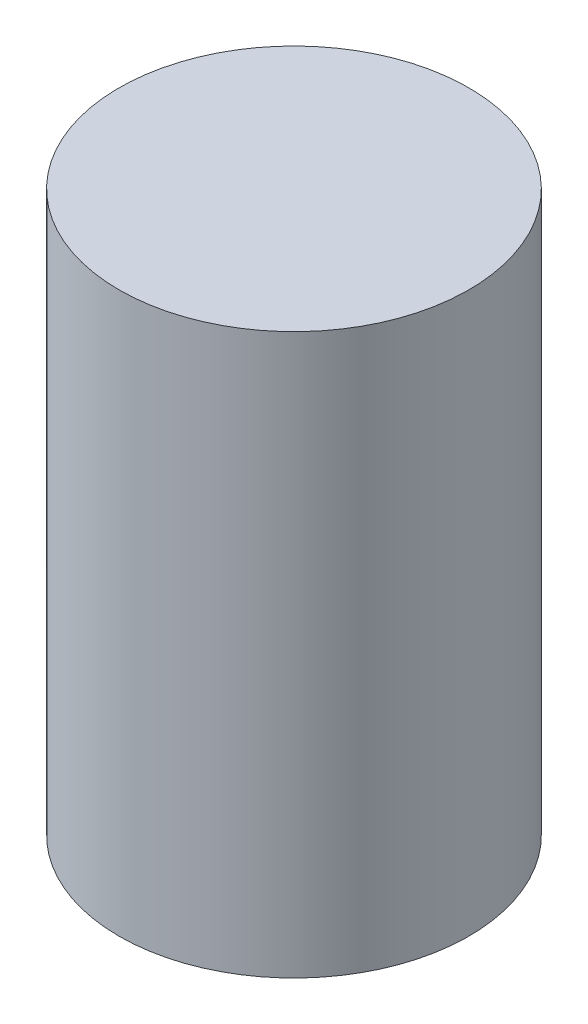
SolidWorks part; units mm, degrees
ref_plane "正面" through (0, 0, 0) normal (0, 0, 1) x (1, 0, 0)
ref_plane "平面" through (0, 0, 0) normal (0, 1, 0) x (1, 0, 0)
ref_plane "右側面" through (0, 0, 0) normal (1, 0, 0) x (0, 0, -1)
sketch "ｽｹｯﾁ1" plane through (0, 0, 0) normal (0, 0, 1) x (1, 0, 0)
  line L0 (0, 0) -> (0, 80)
  dimension "D1" = 80
sketch "ｽｹｯﾁ2" plane through (0, 0, 0) normal (0, 1, 0) x (1, 0, 0)
  circle A0 centre (0, 0) radius 25
  dimension "D1" = 50
sweep "ｽｲｰﾌﾟ1" add profiles "ｽｹｯﾁ2" path "ｽｹｯﾁ1"
